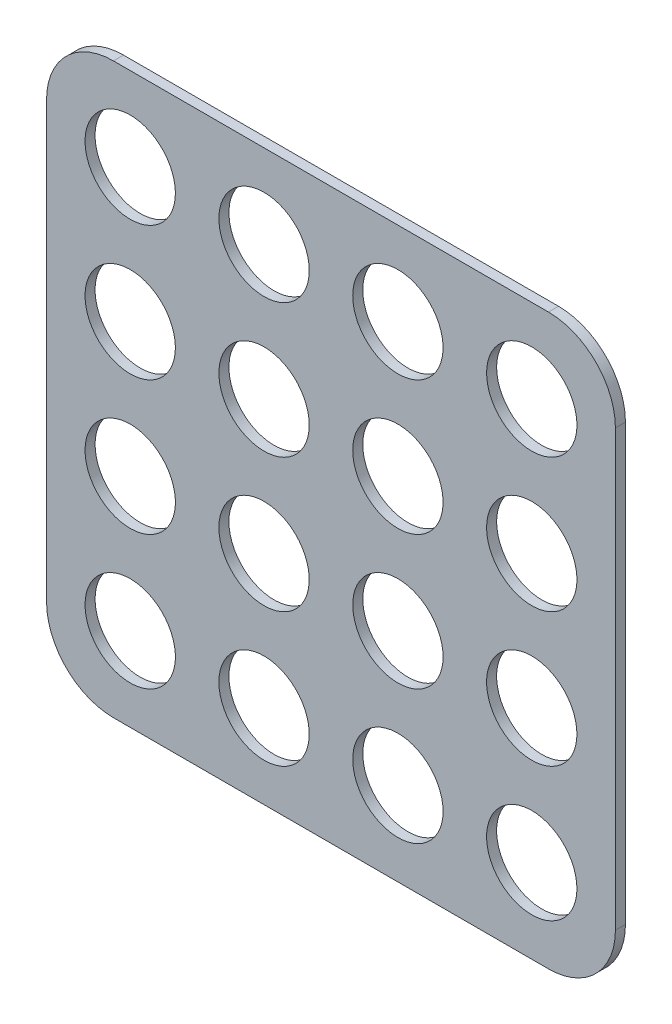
SolidWorks part; units mm, degrees
ref_plane "Plan de face" through (0, 0, 0) normal (0, 0, 1) x (1, 0, 0)
ref_plane "Plan de dessus" through (0, 0, 0) normal (0, 1, 0) x (1, 0, 0)
ref_plane "Plan de droite" through (0, 0, 0) normal (1, 0, 0) x (0, 0, -1)
sketch "Esquisse1" plane through (0, 0, 0) normal (0, 0, 1) x (1, 0, 0)
  line L1 (0, 0) -> (170, 0)
  line L2 (0, 0) -> (0, 170)
  line L3 (0, 170) -> (170, 170)
  line L4 (170, 0) -> (170, 170)
  dimension "D1" = 170
extrude "Boss.-Extru.1" add sketch "Esquisse1" along normal blind 3
fillet "Congé1" radius 20 4 edges at (0, 0, 1.5) (170, 0, 1.5) (0, 170, 1.5) (170, 170, 1.5)
sketch "Esquisse2" plane through (0, 0, 3) normal (0, 0, 1) x (1, 0, 0)
  line L0 (85, 170) -> (85, 98.4631) construction
  line L1 (150, 170) -> (20, 170) construction
  line L2 (0, 85) -> (65.65, 85) construction
  line L3 (0, 150) -> (0, 20) construction
  line L5 (25, 145) -> (65, 145) construction
  line L6 (25, 145) -> (25, 105) construction
  line L7 (25, 105) -> (65, 105) construction
  line L8 (65, 145) -> (65, 105) construction
  circle A0 centre (25, 145) radius 13.5
  circle A1 centre (65, 145) radius 13.5
  circle A2 centre (65, 105) radius 13.5
  circle A3 centre (25, 105) radius 13.5
  circle A4 centre (105, 105) radius 13.5
  circle A5 centre (145, 105) radius 13.5
  circle A6 centre (105, 145) radius 13.5
  circle A7 centre (145, 145) radius 13.5
  circle A8 centre (145, 65) radius 13.5
  circle A9 centre (105, 65) radius 13.5
  circle A10 centre (25, 65) radius 13.5
  circle A11 centre (65, 65) radius 13.5
  circle A12 centre (145, 25) radius 13.5
  circle A13 centre (105, 25) radius 13.5
  circle A14 centre (65, 25) radius 13.5
  circle A15 centre (25, 25) radius 13.5
  dimension "D1" = 27
  dimension "D2" = 40
  dimension "D3" = 40
  dimension "D4" = 40
  dimension "D5" = 40
extrude "Enlèv. mat.-Extru.1" cut sketch "Esquisse2" against normal blind 3
